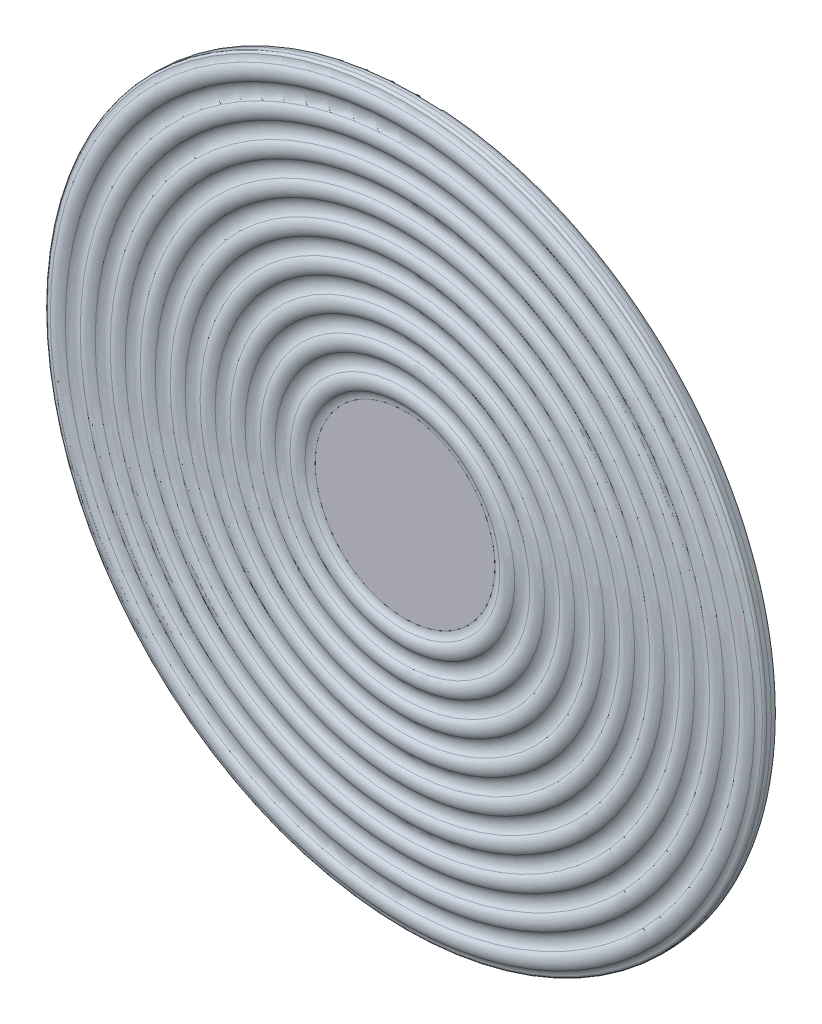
SolidWorks part; units mm, degrees
ref_plane "Alzado" through (0, 0, 0) normal (0, 0, 1) x (1, 0, 0)
ref_plane "Planta" through (0, 0, 0) normal (0, 1, 0) x (1, 0, 0)
ref_plane "Vista lateral" through (0, 0, 0) normal (1, 0, 0) x (0, 0, -1)
sketch "Croquis1" plane through (0, 0, 0) normal (0, 0, 1) x (1, 0, 0)
  circle A0 centre (0, 0) radius 50
  dimension "D1" = 100
extrude "Saliente-Extruir1" add sketch "Croquis1" along normal blind 40
shell "Vaciado1" thickness 3
sketch "Croquis2" plane through (0, 0, 0) normal (0, 1, 0) x (1, 0, 0)
  line L0 (0, 0) -> (0, -40) construction
  line L1 (-50, -40) -> (50, -40) construction
  line L3 (-0.05, -10) -> (0.05, -10)
  line L4 (-1.25, -11.2) -> (-1.25, -28.8)
  line L5 (-0.05, -30) -> (0.05, -30)
  line L6 (1.25, -11.2) -> (1.25, -28.8)
  line L7 (-1.25, -10) -> (1.25, -30) construction
  line L8 (-1.25, -30) -> (1.25, -10) construction
  arc A0 (-1.25, -28.8) -> (-0.05, -30) centre (-0.05, -28.8) ccw
  arc A1 (0.05, -30) -> (1.25, -28.8) centre (0.05, -28.8) ccw
  arc A2 (-0.05, -10) -> (-1.25, -11.2) centre (-0.05, -11.2) ccw
  arc A3 (0.05, -10) -> (1.25, -11.2) centre (0.05, -11.2) cw
  point P5 (0, -20)
  point P10 (0, -30)
  dimension "D3" = 1.2
  dimension "D1" = 2.5
  dimension "D2" = 20
extrude "Cortar-Extruir1" cut sketch "Croquis2" against normal through all and the other way through all
pattern_linear "MatrizL1" count 3 spacing 5 along (1, 0, 0) count 3 spacing 5 along (-1, 0, 0) of "Cortar-Extruir1"
sketch "Croquis3" plane through (0, 0, 40) normal (0, 0, 1) x (1, 0, 0)
  circle A0 centre (0, 0) radius 50
extrude "Saliente-Extruir2" add sketch "Croquis3" along normal blind 26 separate body
sketch "Croquis4" plane through (0, 0, 0) normal (1, 0, 0) x (0, 0, -1)
  line L0 (-66, 50) -> (-66, 150) construction
  line L1 (-75, 150) -> (-75, -84.1665) construction
  line L2 (-66, 150) -> (-75, 150) construction
  line L3 (-66, 150) -> (-75, 150) construction
  line L4 (-66, 37.5) -> (-107.162, 37.5) construction
  line L5 (-66, 50) -> (-66, -50) construction
  line L6 (-72.8062, 37.5) -> (-66, 37.5)
  line L7 (-66, 37.5) -> (-66, 150)
  line L8 (-66, 150) -> (-72.8062, 150)
  line L9 (0, 0) -> (-172.4095, 0) construction
  arc A2 (-73.9031, 146.875) -> (-72.8062, 150) centre (-77.8062, 150) ccw
  arc A3 (-73.9031, 146.875) -> (-73.9031, 140.625) centre (-70, 143.75) ccw
  arc A4 (-73.9031, 134.375) -> (-73.9031, 140.625) centre (-77.8062, 137.5) ccw
  arc A5 (-73.9031, 134.375) -> (-73.9031, 128.125) centre (-70, 131.25) ccw
  arc A6 (-73.9031, 121.875) -> (-73.9031, 128.125) centre (-77.8062, 125) ccw
  arc A7 (-73.9031, 121.875) -> (-73.9031, 115.625) centre (-70, 118.75) ccw
  arc A8 (-73.9031, 109.375) -> (-73.9031, 115.625) centre (-77.8062, 112.5) ccw
  arc A9 (-73.9031, 109.375) -> (-73.9031, 103.125) centre (-70, 106.25) ccw
  arc A10 (-73.9031, 96.875) -> (-73.9031, 103.125) centre (-77.8062, 100) ccw
  arc A11 (-73.9031, 96.875) -> (-73.9031, 90.625) centre (-70, 93.75) ccw
  arc A12 (-73.9031, 84.375) -> (-73.9031, 90.625) centre (-77.8062, 87.5) ccw
  arc A13 (-73.9031, 84.375) -> (-73.9031, 78.125) centre (-70, 81.25) ccw
  arc A14 (-73.9031, 71.875) -> (-73.9031, 78.125) centre (-77.8062, 75) ccw
  arc A15 (-73.9031, 71.875) -> (-73.9031, 65.625) centre (-70, 68.75) ccw
  arc A16 (-73.9031, 59.375) -> (-73.9031, 65.625) centre (-77.8062, 62.5) ccw
  arc A17 (-73.9031, 59.375) -> (-73.9031, 53.125) centre (-70, 56.25) ccw
  arc A18 (-73.9031, 46.875) -> (-73.9031, 53.125) centre (-77.8062, 50) ccw
  arc A19 (-73.9031, 46.875) -> (-73.9031, 40.625) centre (-70, 43.75) ccw
  arc A20 (-72.8062, 37.5) -> (-73.9031, 40.625) centre (-77.8062, 37.5) ccw
  dimension "D4" = 10
  dimension "D3" = 37.5
  dimension "D5" = 10
  dimension "D1" = 100
  dimension "D2" = 75
revolve "Revolución1" add sketch "Croquis4" angle 360 about L9
ref_plane "Plano1" through (0, 0, 72.8062) normal (0, 0, 1) x (1, 0, 0)
sketch "Croquis5" plane through (0, 0, 72.8062) normal (0, 0, 1) x (1, 0, 0)
  circle A0 centre (0, 0) radius 37.5
  dimension "D1" = 75
extrude "Saliente-Extruir3" add sketch "Croquis5" against normal blind 3 separate body
fillet "Redondeo1" radius 4 1 edges at (-150, 0, 66)
fillet "Redondeo2" radius 1 1 edges at (-150, 0, 72.8062)
